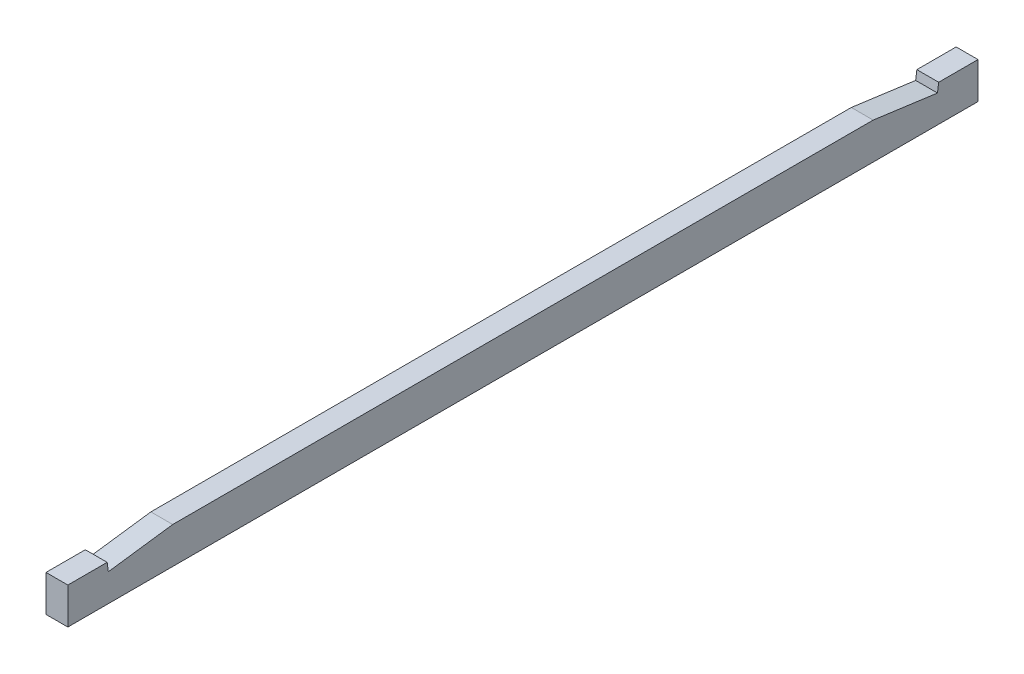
SolidWorks part; units mm, degrees
ref_plane "Face" through (0, 0, 0) normal (0, 0, 1) x (1, 0, 0)
ref_plane "Dessus" through (0, 0, 0) normal (0, 1, 0) x (1, 0, 0)
ref_plane "Droite" through (0, 0, 0) normal (1, 0, 0) x (0, 0, -1)
sketch "Esquisse1" plane through (0, 0, 0) normal (0, 0, 1) x (1, 0, 0)
  line L1 (0, 0) -> (15, 0)
  line L2 (0, 0) -> (0, 25)
  line L3 (0, 25) -> (15, 25)
  line L4 (15, 0) -> (15, 25)
  dimension "D1" = 15
  dimension "D2" = 25
extrude "Extrusion1" add sketch "Esquisse1" along normal blind 625
sketch "Esquisse2" plane through (0, 0, 0) normal (-1, 0, 0) x (0, 0, 1)
  line L0 (27, 25) -> (66.0289, 50.8228)
  line L1 (27, 25) -> (27.8148, 19)
  line L2 (27.8148, 19) -> (72, 25)
  line L3 (72, 25) -> (66.0289, 50.8228)
  line L4 (625, 25) -> (0, 25) construction
  line L5 (0, 25) -> (0, 0) construction
  line L6 (312.5, 68.0012) -> (312.5, -28.0717) construction
  line L7 (625, 25) -> (625, 0) construction
  line L8 (553, 25) -> (558.9711, 50.8228)
  line L9 (597.1852, 19) -> (553, 25)
  line L10 (598, 25) -> (597.1852, 19)
  line L11 (598, 25) -> (558.9711, 50.8228)
  dimension "D1" = 6
  dimension "D2" = 146.51
  dimension "D3" = 27
  dimension "D4" = 45
  dimension "D5" = 90
  dimension "D6" = 312.5
extrude "Enlèv. mat.-Extru.1" cut sketch "Esquisse2" against normal through all
